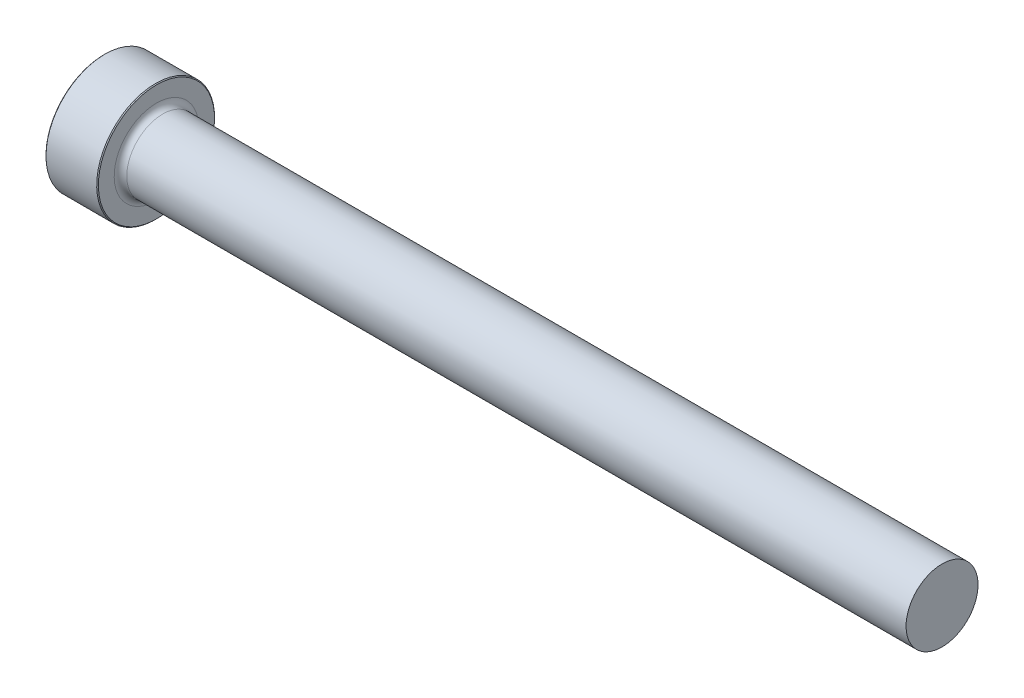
SolidWorks part; units mm, degrees
ref_plane "Front Plane" through (0, 0, 0) normal (0, 0, 1) x (1, 0, 0)
ref_plane "Top Plane" through (0, 0, 0) normal (0, 1, 0) x (1, 0, 0)
ref_plane "Right Plane" through (0, 0, 0) normal (1, 0, 0) x (0, 0, -1)
sketch "Sketch1" plane through (0, 0, 0) normal (0, 0, 1) x (1, 0, 0)
  line L0 (0, 0) -> (0, 7.1437)
  line L1 (0, 7.1437) -> (6.35, 7.1437)
  line L2 (6.35, 7.1437) -> (6.35, 5.1238)
  line L3 (7.112, 4.3618) -> (101.6, 4.3618)
  line L4 (101.6, 4.3618) -> (101.6, 0)
  line L5 (101.6, 0) -> (0, 0)
  line L6 (101.6, 0) -> (101.6, -4.3618) construction
  line L7 (101.6, -4.3618) -> (6.35, -4.3618) construction
  line L8 (0, 0) -> (0, -7.1437) construction
  line L9 (0, -7.1437) -> (6.35, -7.1437) construction
  line L10 (6.35, -7.1437) -> (6.35, -4.3618) construction
  arc A0 (6.35, 5.1238) -> (7.112, 4.3618) centre (7.112, 5.1238) ccw
  dimension "D4" = 0.762
  dimension "L" = 101.6
  dimension "D" = 8.7236
  dimension "H" = 14.2875
  dimension "T" = 6.35
revolve "Revolve1" add sketch "Sketch1" angle 360 about L5
chamfer "Chamfer1" distance 0.1016 angle 45 2 edges at (0, 7.1437, 0) (6.35, 7.1437, 0)
